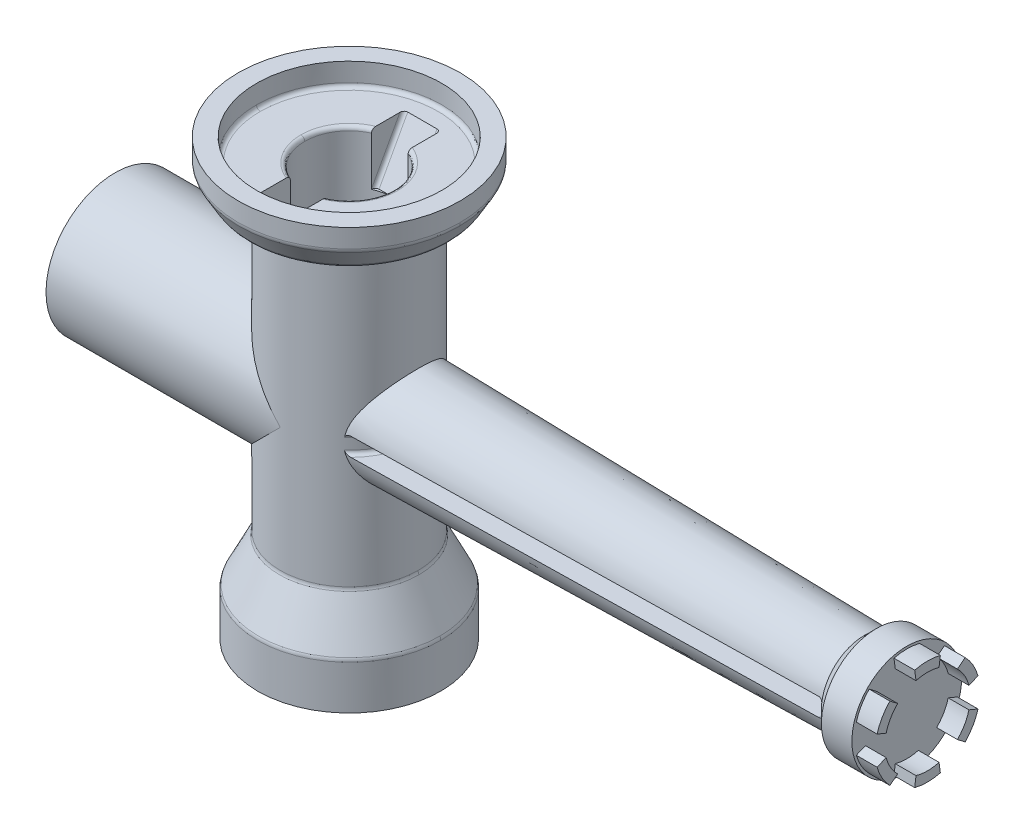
SolidWorks part; units mm, degrees
ref_plane "Front Plane" through (0, 0, 0) normal (0, 0, 1) x (1, 0, 0)
ref_plane "Top Plane" through (0, 0, 0) normal (0, 1, 0) x (1, 0, 0)
ref_plane "Right Plane" through (0, 0, 0) normal (1, 0, 0) x (0, 0, -1)
imported_body "Surface-Imported1"
imported_body "Surface-Imported2"
ref_plane "End of Part" through (-24.384, 0, 0) normal (1, 0, 0) x (0, 0, -1)
ref_plane "Plane2" through (-7.1755, 0, 0) normal (1, 0, 0) x (0, 0, -1)
ref_plane "Trim Plane" through (-16.037, 0, 0) normal (1, 0, 0) x (0, 0, -1)
surface "Surface-Trim1"
surface "Surface-Extend1"
surface "Surface-Extend2"
surface "Surface-Fill1"
surface "Surface-Knit1"
